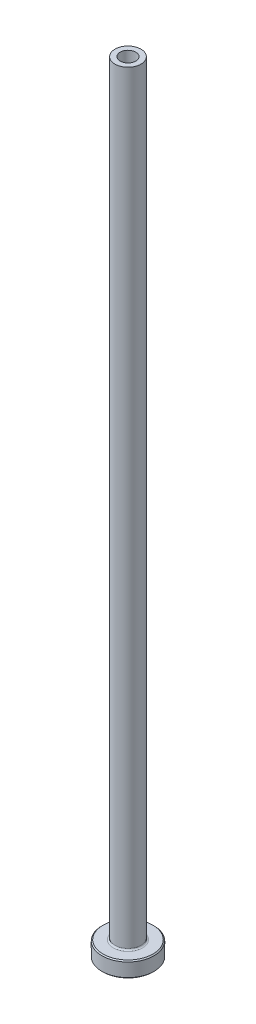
SolidWorks part; units mm, degrees
ref_plane "Front Plane" through (0, 0, 0) normal (0, 0, 1) x (1, 0, 0)
ref_plane "Top Plane" through (0, 0, 0) normal (0, 1, 0) x (1, 0, 0)
ref_plane "Right Plane" through (0, 0, 0) normal (1, 0, 0) x (0, 0, -1)
sketch "Sketch1" plane through (0, 0, 0) normal (0, 0, 1) x (1, 0, 0)
  line L0 (-1.5, 150) -> (-2.5, 150)
  line L1 (-2.5, 150) -> (-2.5, 3)
  line L2 (-2.5, 3) -> (-5, 3)
  line L3 (-5, 3) -> (-5, 0)
  line L4 (5.5, 0) -> (-5.5, 0) construction
  line L5 (-5, 0) -> (-1.75, 0)
  line L6 (-1.5, 105) -> (-1.5, 150)
  line L7 (0, 92.1877) -> (0, -15.5353) construction
  line L8 (0, -5.5) -> (0, 5.5) construction
  line L9 (-1.5, 105) -> (-1.75, 93)
  line L10 (-1.75, 93) -> (-1.75, 0)
  dimension "D1" = 0.25
  dimension "ID" = 3
  dimension "OD" = 5
  dimension "L" = 150
  dimension "H" = 10
  dimension "T" = 3
  dimension "N" = 45
  dimension "D2" = 12
revolve "Revolve1" add sketch "Sketch1" angle 360 about L7
fillet "Fillet1" radius 0.3 1 edges at (0, 3, 2.5)
chamfer "Chamfer1" distance 0.2 angle 45 2 edges at (0, 3, 5) (0, 0, 5)
chamfer "Chamfer3" distance 0.5 angle 45 1 edges at (0, 0, 1.75)
